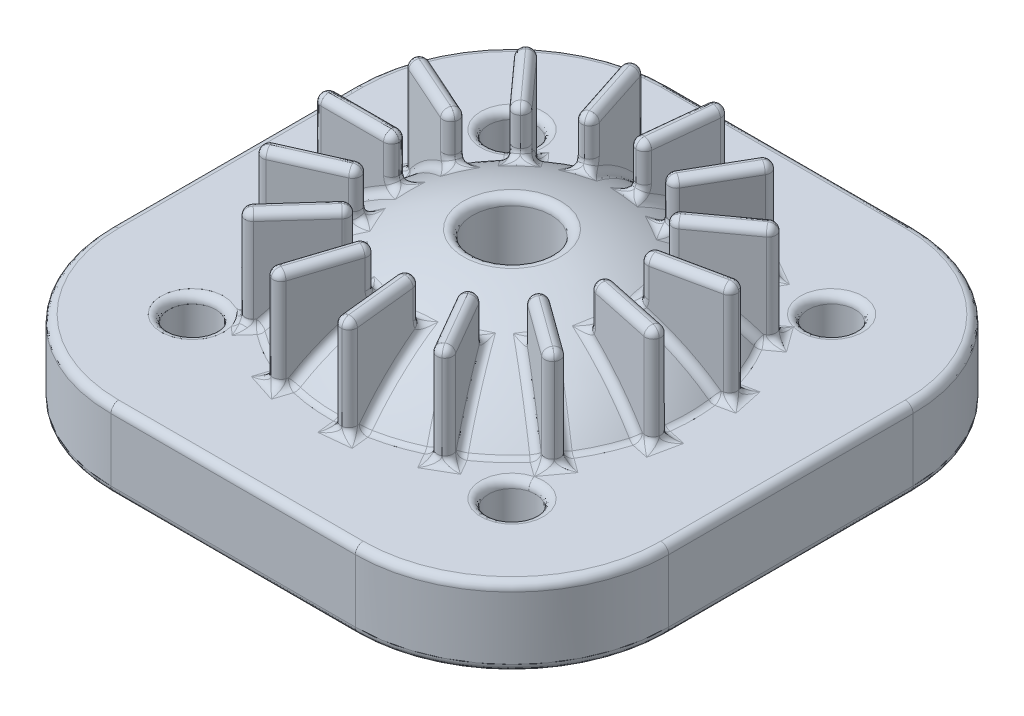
SolidWorks part; units mm, degrees
ref_plane "Front Plane" through (0, 0, 0) normal (0, 0, 1) x (1, 0, 0)
ref_plane "Top Plane" through (0, 0, 0) normal (0, 1, 0) x (1, 0, 0)
ref_plane "Right Plane" through (0, 0, 0) normal (1, 0, 0) x (0, 0, -1)
sketch "Sketch1" plane through (0, 0, 0) normal (0, 1, 0) x (1, 0, 0)
  line L0 (78.5571, 0) -> (0, 0) construction
  line L1 (-39, 89) -> (39, 89)
  line L2 (39, -89) -> (-39, -89)
  line L3 (-89, 39) -> (-89, -39)
  line L4 (89, 39) -> (89, -39)
  line L5 (0, 0) -> (0, 75.4994) construction
  arc A0 (39, -89) -> (89, -39) centre (39, -39) ccw
  arc A1 (-89, -39) -> (-39, -89) centre (-39, -39) ccw
  arc A2 (39, 89) -> (89, 39) centre (39, 39) cw
  arc A3 (-39, 89) -> (-89, 39) centre (-39, 39) ccw
  dimension "D3" = 50
  dimension "D1" = 178
  dimension "D2" = 178
extrude "Boss-Extrude1" add sketch "Sketch1" along normal blind 25
sketch "Sketch2" plane through (0, 0, 0) normal (0, -1, 0) x (1, 0, 0)
  line L0 (50.8, 0) -> (0, 0) construction
  line L1 (0, 0) -> (0, 50.8) construction
  arc A0 (-44.6757, 61.1982) -> (-61.1982, 44.6757) centre (-51, 51) ccw
  arc A1 (61.1982, 44.6757) -> (44.6757, 61.1982) centre (51, 51) ccw
  arc A2 (44.6757, -61.1982) -> (61.1982, -44.6757) centre (51, -51) ccw
  arc A3 (-61.1982, -44.6757) -> (-44.6757, -61.1982) centre (-51, -51) ccw
  arc A4 (-26.3191, 57.9871) -> (26.3191, 57.9871) centre (0, -66.2558) cw
  arc A5 (-57.9871, 26.3191) -> (-57.9871, -26.3191) centre (66.2558, 0) ccw
  arc A6 (-26.3191, -57.9871) -> (26.3191, -57.9871) centre (0, 66.2558) ccw
  arc A7 (57.9871, -26.3191) -> (57.9871, 26.3191) centre (-66.2558, 0) ccw
  arc A8 (-26.3191, 57.9871) -> (-44.6757, 61.1982) centre (-31.5, 82.4444) cw
  arc A9 (26.3191, 57.9871) -> (44.6757, 61.1982) centre (31.5, 82.4444) ccw
  arc A10 (57.9871, 26.3191) -> (61.1982, 44.6757) centre (82.4444, 31.5) cw
  arc A11 (57.9871, -26.3191) -> (61.1982, -44.6757) centre (82.4444, -31.5) ccw
  arc A12 (44.6757, -61.1982) -> (26.3191, -57.9871) centre (31.5, -82.4444) ccw
  arc A13 (-57.9871, -26.3191) -> (-61.1982, -44.6757) centre (-82.4444, -31.5) cw
  arc A14 (-57.9871, 26.3191) -> (-61.1982, 44.6757) centre (-82.4444, 31.5) ccw
  arc A15 (-26.3191, -57.9871) -> (-44.6757, -61.1982) centre (-31.5, -82.4444) ccw
  dimension "D2" = 24
  dimension "D4" = 127
  dimension "D5" = 25
  dimension "D7" = 63
  dimension "D1" = 102
  dimension "D3" = 102
  dimension "D8" = 63
extrude "Boss-Extrude2" add sketch "Sketch2" along normal blind 6.5
sketch "Sketch3" plane through (0, 0, 0) normal (0, 0, 1) x (1, 0, 0)
  line L0 (0, 0) -> (0, 82.3135) construction
  line L1 (0, 25) -> (57, 25)
  line L2 (-39, 25) -> (39, 25) construction
  line L3 (89, 25) -> (39, 25) construction
  line L4 (0, 50) -> (0, 25)
  arc A0 (57, 25) -> (0, 50) centre (0.6503, -25.9972) ccw
  dimension "D2" = 76
  dimension "D1" = 114
  dimension "D3" = 25
revolve "Revolve1" add sketch "Sketch3" angle 360 about L0
sketch "Sketch4" plane through (0, 0, 0) normal (0, 0, 1) x (1, 0, 0)
  line L0 (0, -6.5) -> (0, 64.7714) construction
  line L1 (-26.3191, -6.5) -> (26.3191, -6.5) construction
  line L2 (0, -6.5) -> (57, -6.5)
  line L3 (0, 18.5) -> (0, -6.5)
  arc A0 (57, -6.5) -> (0, 18.5) centre (0.6503, -57.4972) ccw
  dimension "D2" = 76
  dimension "D1" = 114
  dimension "D3" = 25
revolve "Cut-Revolve1" cut sketch "Sketch4" angle 360 about L0
sketch "Sketch6" plane through (0, -6.5, 0) normal (0, -1, 0) x (1, 0, 0)
  circle A0 centre (-51, 51) radius 7.5
  circle A1 centre (51, 51) radius 7.5
  circle A2 centre (51, -51) radius 7.5
  circle A3 centre (-51, -51) radius 7.5
  circle A4 centre (0, 0) radius 12.5
  dimension "D1" = 25
  dimension "D2" = 15
extrude "Cut-Extrude1" cut sketch "Sketch6" against normal through all
ref_plane "Plane1" through (0, 57, 0) normal (0, 1, 0) x (-1, 0, 0)
sketch "Sketch7" plane through (0, 57, 0) normal (0, 1, 0) x (-1, 0, 0)
  line L0 (0, 0) -> (76.9399, 0) construction
  line L2 (36, 2.5) -> (61, 2.5)
  line L3 (36, 2.5) -> (36, -2.5)
  line L4 (36, -2.5) -> (61, -2.5)
  line L5 (61, 2.5) -> (61, -2.5)
  dimension "D1" = 36
  dimension "D2" = 25
  dimension "D3" = 5
extrude "Boss-Extrude3" add sketch "Sketch7" against normal up to next
pattern_circular "CirPattern1" count 15 over 360 about axis through (0, 0, 0) along (0, 1, 0) of "Boss-Extrude3"
fillet "Fillet3" radius 2.5 25 edges at (35.8078, 0, 57.8183) (59.4853, 0, 59.4853) (57.8183, 0, 35.8078) (60.7442, 0, 0) (57.8183, 0, -35.8078) (59.4853, 0, -59.4853) (35.8078, 0, -57.8183) (0, 0, -60.7442) (-35.8078, 0, -57.8183) (-59.4853, 0, -59.4853) (-57.8183, 0, -35.8078) (-60.7442, 0, 0) (-57.8183, 0, 35.8078) (-59.4853, 0, 59.4853) (-35.8078, 0, 57.8183) (0, 0, 60.7442) (-89, 0, 0) (-74.3553, 0, 74.3553) (0, 0, 89) (74.3553, 0, 74.3553) (89, 0, 0) (74.3553, 0, -74.3553) (0, 0, -89) (-74.3553, 0, -74.3553) (-51, 25, 58.5)
fillet "Fillet4" radius 2.5 105 edges at (55.9335, -78.0894, -2.5) (47.3927, -85.872, 2.5) (-55.7544, 25, 11.851) (52.0721, 25, 23.184) (57, 25, 0) (52.0721, 25, -23.184) (38.1404, 25, -42.3593) (17.614, 25, -54.2102) (-5.9581, 25, -56.6877) (-28.5, 25, -49.3634) (-46.114, 25, -33.5038) (-46.114, 25, 33.5038) (-28.5, 25, 49.3634) (-5.9581, 25, 56.6877) (17.614, 25, 54.2102) (38.1404, 25, 42.3593) (-55.7544, 25, -11.851) (-58.9726, 25, -2.5) (-61, 25, 0) (-58.9726, 25, 2.5) (46.2404, 25, 36.6858) (49.35, 25, 35.8549) (49.1793, 25, 32.6407) (57.1641, 25, 14.7065) (59.667, 25, 12.6826) (58.2037, 25, 9.8157) (58.2037, 25, -9.8157) (59.667, 25, -12.6826) (57.1641, 25, -14.7065) (49.1793, 25, -32.6407) (49.35, 25, -35.8549) (46.2404, 25, -36.6858) (31.6514, 25, -49.8217) (30.5, 25, -52.8275) (27.3212, 25, -52.3217) (8.6506, 25, -58.3882) (6.3762, 25, -60.6658) (3.678, 25, -58.9108) (-15.8459, 25, -56.8588) (-18.85, 25, -58.0144) (-20.6012, 25, -55.3137) (-37.6025, 25, -45.498) (-40.817, 25, -45.3318) (-41.3182, 25, -42.1523) (-54.891, 25, 21.7024) (-55.7263, 25, 24.8109) (-52.8573, 25, 26.2702) (-41.3182, 25, 42.1523) (-40.817, 25, 45.3318) (-37.6025, 25, 45.498) (-20.6012, 25, 55.3137) (-18.85, 25, 58.0144) (-15.8459, 25, 56.8588) (3.678, 25, 58.9108) (6.3762, 25, 60.6658) (8.6506, 25, 58.3882) (27.3212, 25, 52.3217) (30.5, 25, 52.8275) (31.6514, 25, 49.8217) (-52.8573, 25, -26.2702) (-55.7263, 25, -24.8109) (-54.891, 25, -21.7024)
fillet "Fillet5" radius 2.5 53 edges at (-36, 51.128, 2.5) (-48.5, 57, 2.5) (-61, 42.25, 2.5) (-13.4927, 44.8646, -33.4362) (-22.1503, 25.7322, -57.712) (-21.1896, 43.1155, -27.7683) (20.0945, 44.4276, -29.8047) (14.9532, 43.1155, -31.567) (6.2346, 44.4276, -35.4012) (0.821, 43.1155, -34.9199) (26.4999, 43.1155, -22.7559) (27.6302, 44.8646, -23.1647) (-32.9571, 43.1155, 11.5717) (-31.8427, 44.8646, 16.9139) (-25.8522, 44.4276, 24.9756) (-42.6814, 27.2901, 43.6531) (-13.4532, 43.1155, 32.2349) (-13.4587, 44.4276, 33.3313) (28.0669, 25.7322, 55.0778) (19.8612, 43.1155, 28.7334) (20.1497, 44.8646, 29.9003) (-31.7419, 44.4276, -16.869) (1.262, 44.4276, 35.9238) (3.2382, 25.7322, 61.7319) (9.6673, 25.7322, 61.0562) (6.2461, 44.8646, 35.5108) (48.0426, 25.7322, 38.9002) (29.8311, 43.1155, 18.171) (30.5692, 44.8646, 19.1196) (61.0553, 25.7322, 9.6733) (-17.365, 57, -45.3537) (-22.2308, 51.128, -28.426) (-42.6748, 42.25, -43.659) (-34.3107, 57, -34.3697) (32.6651, 42.25, -51.5775) (22.0849, 57, -43.2522) (7.5559, 57, -47.973) (-45.3238, 57, 17.4429) (-54.7094, 42.25, 27.0948) (-43.2901, 57, 22.0106) (-25.9466, 51.128, 25.0804) (-30.595, 57, 37.7154) (-38.9591, 42.25, 47.0047) (-42.6748, 42.25, 43.659) (-13.5023, 51.128, 33.4655) (-12.6097, 57, 46.8988) (28.3349, 42.25, 54.0775) (20.1651, 51.128, 29.9269) (-56.7431, 42.25, -22.5271) (1.2767, 51.128, 36.0641) (30.5941, 51.128, 19.1377) (60.1868, 42.25, 10.2372) (34.6935, 51.128, -9.9302)
fillet "Fillet6" radius 2.5 15 edges at (-35.8078, -6.5, 57.8183) (-59.4853, -6.5, 59.4853) (-57.8183, -6.5, 35.8078) (-60.7442, -6.5, 0) (-57.8183, -6.5, -35.8078) (-59.4853, -6.5, -59.4853) (-35.8078, -6.5, -57.8183) (0, -6.5, -60.7442) (35.8078, -6.5, -57.8183) (57.8183, -6.5, -35.8078) (60.7442, -6.5, 0) (57.8183, -6.5, 35.8078) (35.8078, -6.5, 57.8183) (0, -6.5, 60.7442) (0, -6.5, -57)
fillet "Fillet7" radius 2.5 13 edges at (-51, -6.5, -58.5) (51, 25, 58.5) (51, 25, -43.5) (-51, 25, -43.5) (74.3553, 25, 74.3553) (0, 25, 89) (-74.3553, 25, 74.3553) (-89, 25, 0) (-74.3553, 25, -74.3553) (0, 25, -89) (74.3553, 25, -74.3553) (89, 25, 0) (-51, -6.5, 43.5)
